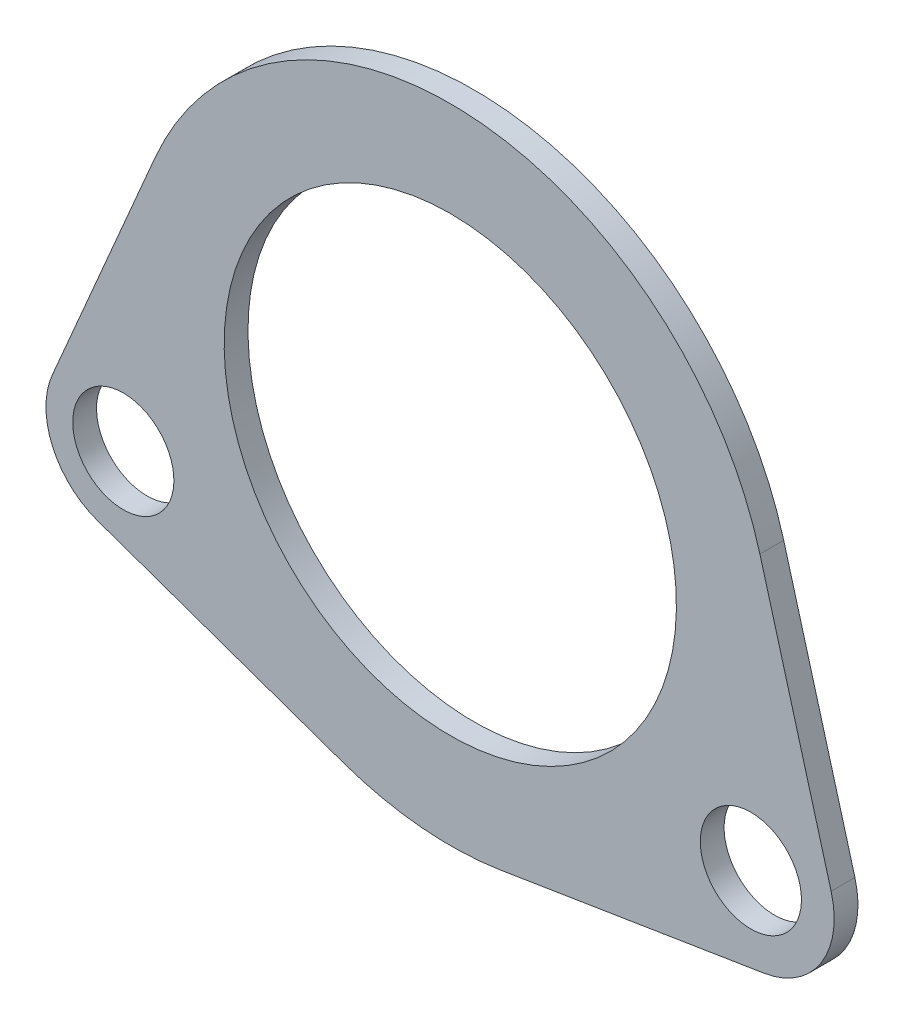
SolidWorks part; units mm, degrees
ref_plane "Plan1" through (0, 0, 0) normal (0, 0, 1) x (1, 0, 0)
ref_plane "Plan2" through (0, 0, 0) normal (0, 1, 0) x (1, 0, 0)
ref_plane "Plan3" through (0, 0, 0) normal (1, 0, 0) x (0, 0, -1)
sketch "Esquisse3" plane through (0, 0, 36.3685) normal (0, 0, -1) x (-1, 0, 0)
  line L0 (12.1655, -53.0861) -> (-8.0523, 33.1574) construction
  line L1 (-34.5464, -4.6469) -> (-28.5614, 16.8979)
  line L2 (-28.9144, -13.4315) -> (-6.838, -16.9857)
  line L3 (54.7849, -18.0108) -> (47.088, 14.8219) construction
  line L4 (-58.3906, -3.4202) -> (56.1237, 23.425) construction
  line L5 (22.2667, 20.3157) -> (30.9019, 0.1865)
  line L6 (6.4344, -15.7915) -> (27.0904, -8.5059)
  circle A0 centre (-2.5465, 9.6711) radius 23.5 construction
  circle A1 centre (-27.8018, -6.5205) radius 4.25
  arc A2 (-34.5464, -4.6469) -> (-28.9144, -13.4315) centre (-27.8018, -6.5205) ccw
  circle A4 centre (-2.5465, 9.6711) radius 19
  circle A5 centre (24.9283, -2.3761) radius 4.25
  arc A6 (27.0904, -8.5059) -> (30.9019, 0.1865) centre (24.9283, -2.3761) ccw
  arc A7 (22.2667, 20.3157) -> (-28.5614, 16.8979) centre (-2.5465, 9.6711) ccw
  arc A9 (-6.838, -16.9857) -> (6.4344, -15.7915) centre (-2.5465, 9.6711) ccw
  dimension "D1" = 27
  dimension "D2" = 38
  dimension "D5" = 8.5
  dimension "D6" = 13
  dimension "D7" = 8.5
  dimension "D10" = 14
  dimension "D3" = 30
  dimension "D4" = 10
  dimension "D8" = 30
  dimension "D9" = 18
extrude "Extrusion1" add sketch "Esquisse3" along normal blind 2
